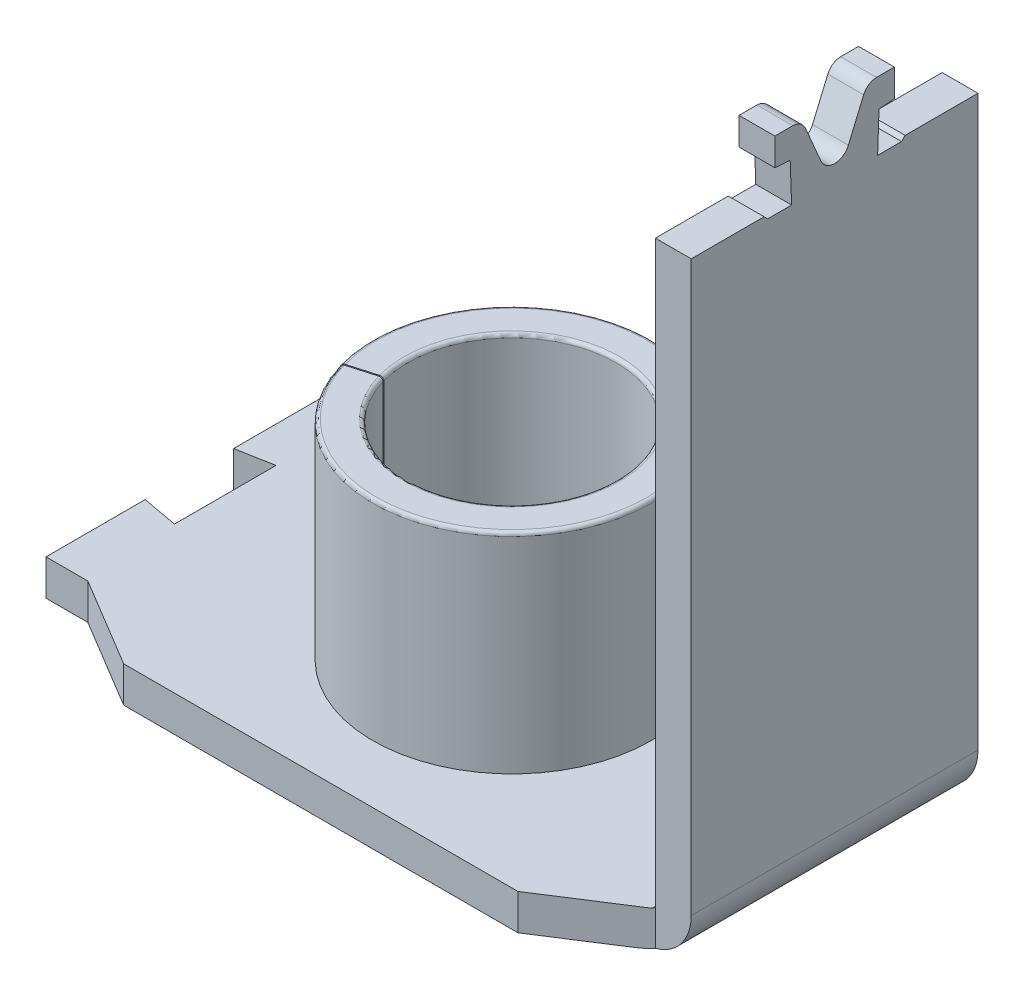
SolidWorks part; units mm, degrees
ref_plane "Plan de face" through (0, 0, 0) normal (0, 0, 1) x (1, 0, 0)
ref_plane "Plan de dessus" through (0, 0, 0) normal (0, 1, 0) x (1, 0, 0)
ref_plane "Plan de droite" through (0, 0, 0) normal (1, 0, 0) x (0, 0, -1)
sketch "Esquisse1" plane through (0, 0, 0) normal (0, 0, 1) x (1, 0, 0)
  line L1 (-4, 0) -> (-54, 0)
  line L3 (-3.2, 3) -> (-54, 3)
  line L4 (-54, 0) -> (-54, 3)
  line L6 (0, 4) -> (0, 57)
  line L7 (0, 57) -> (-3, 57)
  line L8 (-3, 3.2) -> (-3, 57)
  arc A0 (-4, 0) -> (0, 4) centre (-4, 4) ccw
  arc A1 (-3.2, 3) -> (-3, 3.2) centre (-3.2, 3.2) ccw
  point P9 (0, 0)
  dimension "D3" = 4
  dimension "D4" = 0.2
  dimension "D1" = 3
  dimension "D2" = 3
  dimension "D5" = 3
  dimension "D6" = 3
  dimension "D7" = 57
  dimension "D8" = 54
extrude "Extrusion1" add sketch "Esquisse1" along normal mid plane 33
sketch "Esquisse2" plane through (0, 3, 0) normal (0, 1, 0) x (-1, 0, 0)
  line L0 (3, -12) -> (10, -16.5)
  line L1 (3.2, 16.5) -> (54, 16.5) construction
  line L2 (10, 16.5) -> (43, 16.5)
  line L3 (43, 16.5) -> (50.4979, 12)
  line L4 (50.4979, 12) -> (57, 12)
  line L5 (57, 12) -> (57, 3.7)
  line L6 (57, 3.7) -> (54, 3.7)
  line L7 (54, 16.5) -> (54, -16.5) construction
  line L8 (51, -4.25) -> (51, 4.25)
  line L9 (51, 4.25) -> (54, 3.7)
  line L10 (0, 0) -> (56.3459, 0) construction
  line L11 (0, 12) -> (0, -12)
  line L12 (0, 16.5) -> (0, -16.5) construction
  line L13 (0, 12) -> (3, 12)
  line L14 (3, 16.5) -> (3, -16.5) construction
  line L15 (3, 12) -> (10, 16.5)
  line L16 (0, -12) -> (3, -12)
  line L18 (51, -4.25) -> (54, -3.7)
  line L19 (57, -3.7) -> (54, -3.7)
  line L20 (57, -12) -> (57, -3.7)
  line L21 (50.4979, -12) -> (57, -12)
  line L22 (43, -16.5) -> (50.4979, -12)
  line L23 (10, -16.5) -> (43, -16.5)
  circle A0 centre (27, 0) radius 11.65
  point P18 (15.35, 0)
  point P28 (51, 0)
  point P34 (38.65, 0)
  dimension "D9" = 23.3
  dimension "D11" = 6
  dimension "D1" = 33
  dimension "D2" = 11
  dimension "D3" = 12
  dimension "D4" = 3.5021
  dimension "D5" = 8.3
  dimension "D6" = 4.25
  dimension "D7" = 3
  dimension "D8" = 12
  dimension "D10" = 27
extrude "Enlèv. mat.-Extru.1" cut sketch "Esquisse2" along normal through all and the other way blind 33 flip side to cut
sketch "Esquisse3" plane through (-3, 0, 0) normal (-1, 0, 0) x (0, 0, 1)
  line L0 (12, 57) -> (-12, 57) construction
  line L1 (3.6, 51.3) -> (3.7158, 54.6)
  line L2 (-3.5, 61.5076) -> (3.5, 61.5076)
  line L3 (3.6, 51.3) -> (5.6, 51.3)
  line L4 (5.6, 51.3) -> (5.9, 51.6)
  line L5 (5.9, 51.6) -> (12, 51.6)
  line L6 (12, 51.6) -> (12, 57)
  line L7 (12, 57) -> (5, 57)
  line L8 (3.5, 61.5076) -> (3.5, 57)
  line L9 (0, 62.174) -> (0, 50.9071) construction
  line L10 (1.1502, 53.2605) -> (2.4311, 56.2704)
  line L11 (3.7158, 54.6) -> (5, 54.7)
  line L12 (-5, 54.7) -> (-5, 57)
  line L13 (-3.7158, 54.6) -> (-5, 54.7)
  line L14 (-1.1502, 53.2605) -> (-2.4311, 56.2704)
  line L15 (-3.5, 61.5076) -> (-3.5, 57)
  line L16 (-12, 57) -> (-5, 57)
  line L17 (-12, 51.6) -> (-12, 57)
  line L18 (-5.9, 51.6) -> (-12, 51.6)
  line L19 (12, 57) -> (12, 3.2) construction
  line L20 (-5.6, 51.3) -> (-5.9, 51.6)
  line L21 (-3.6, 51.3) -> (-5.6, 51.3)
  line L22 (-3.6, 51.3) -> (-3.7158, 54.6)
  line L45 (5, 54.7) -> (5, 57)
  arc A0 (-1.1502, 53.2605) -> (1.1502, 53.2605) centre (0, 53.75) ccw
  arc A1 (-3.5, 57) -> (-2.4311, 56.2704) centre (-3.5353, 55.8005) cw
  arc A4 (3.5, 57) -> (2.4311, 56.2704) centre (3.5353, 55.8005) ccw
  point P2 (0, 52.5)
  point P33 (0, 61.5076)
  point P67 (0, 61.5076)
  dimension "D1" = 2.5
  dimension "D10" = 2.4
  dimension "D5" = 4.5
  dimension "D6" = 2.4
  dimension "D2" = 4.5
  dimension "D3" = 3.6
  dimension "D4" = 3.5
  dimension "D7" = 2.3
  dimension "D8" = 2
  dimension "D9" = 135
  dimension "D11" = 3.7158
  dimension "D12" = 0.9
extrude "Enlèv. mat.-Extru.2" cut sketch "Esquisse3" against normal through all
sketch "Esquisse5" plane through (0, 0, 0) normal (0, -1, 0) x (1, 0, 0)
  circle A0 centre (-27, 0) radius 11.65
  circle A1 centre (-27, 0) radius 8.725
  dimension "D1" = 17.45
  dimension "D2" = 23.3
extrude "Extrusion2" add sketch "Esquisse5" against normal blind 20.5
fillet "Congé1" radius 0.3 3 edges at (-15.35, 20.5, 0) (-18.275, 20.5, 0) (-18.275, 0, 0)
sketch "Esquisse6" plane through (0, 0, 0) normal (0, -1, 0) x (1, 0, 0)
  circle A0 centre (-27, 0) radius 11.65
  circle A1 centre (-27, 0) radius 11.6
  dimension "D1" = 23.3
  dimension "D2" = 23.2
extrude "Enlèv. mat.-Extru.3" cut sketch "Esquisse6" against normal blind 0.5
sketch "Esquisse7" plane through (0, 0, 0) normal (0, -1, 0) x (1, 0, 0)
  line L0 (-38.1519, 3.1928) -> (-35.3481, 2.3901)
  line L1 (-35.3481, 2.3901) -> (-35.3756, 2.294)
  line L2 (-35.3756, 2.294) -> (-38.1795, 3.0967)
  line L3 (-27, 0) -> (-42.5532, 4.4529) construction
  line L4 (-38.1519, 3.1928) -> (-38.1795, 3.0967)
  circle A1 centre (-27, 0) radius 11.6 construction
  dimension "D1" = 0.1
extrude "Enlèv. mat.-Extru.4" cut sketch "Esquisse7" against normal through all
